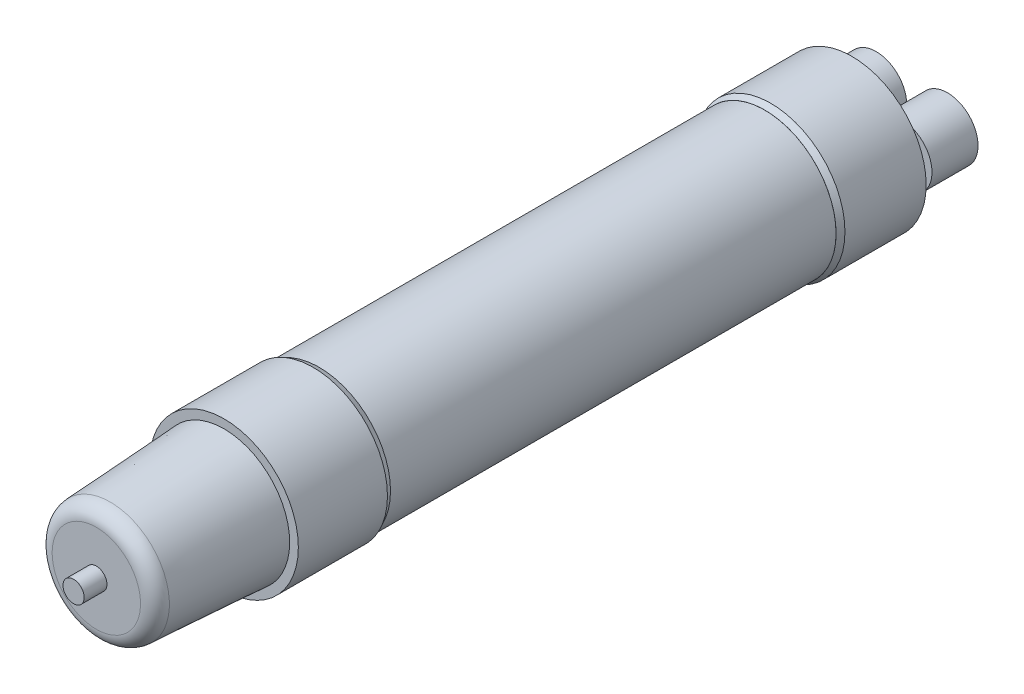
SolidWorks part; units mm, degrees
ref_plane "Plane1" through (0, 0, 0) normal (0, 0, 1) x (1, 0, 0)
ref_plane "Plane2" through (0, 0, 0) normal (0, 1, 0) x (1, 0, 0)
ref_plane "Plane3" through (0, 0, 0) normal (1, 0, 0) x (0, 0, -1)
sketch "Sketch1" plane through (0, 0, 0) normal (0, 0, 1) x (1, 0, 0)
  circle A0 centre (0, 0) radius 31.75
  dimension "D1" = 63.5
extrude "EndCap" add sketch "Sketch1" along normal blind 43.18
sketch "Sketch2" plane through (0, 0, 43.18) normal (0, 0, 1) x (1, 0, 0)
  circle A0 centre (0, 0) radius 30.48
  dimension "D1" = 60.96
extrude "Can" add sketch "Sketch2" along normal blind 190.5
sketch "Sketch3" plane through (0, 0, 233.68) normal (0, 0, 1) x (1, 0, 0)
  circle A0 centre (0, 0) radius 31.75
  dimension "D1" = 63.5
extrude "EndCap2" add sketch "Sketch3" along normal blind 40.64
sketch "Sketch4" plane through (0, 0, 0) normal (0, 1, 0) x (1, 0, 0)
  line L0 (0, 0) -> (0, -348.1702) construction
  line L1 (0, -43.18) -> (0, 0) construction
  line L2 (0, -274.32) -> (-99.0456, -274.32) construction
  line L3 (0, -274.32) -> (-28.0416, -274.32)
  line L4 (-28.0416, -274.32) -> (-25.2371, -322.9456)
  line L5 (-18.8977, -328.93) -> (0, -328.93)
  line L6 (-31.75, -274.32) -> (31.75, -274.32) construction
  line L7 (0, -274.32) -> (0, -328.93)
  arc A0 (-25.2371, -322.9456) -> (-18.8977, -328.93) centre (-18.8977, -322.58) ccw
  point P12 (-24.892, -328.93)
  dimension "D4" = 6.35
  dimension "D1" = 28.0416
  dimension "D2" = 24.892
  dimension "D3" = 54.61
revolve "Hydrophone" add sketch "Sketch4" angle 360 about L0
chamfer "Chamfer1" distance 12.7 angle 25
chamfer "Chamfer5" distance 2.54 angle 26
chamfer "Chamfer6" distance 2.54 angle 26
sketch "Sketch5" plane through (0, 0, 328.93) normal (0, 0, 1) x (1, 0, 0)
  circle A0 centre (0, 0) radius 4.5339
  dimension "D1" = 9.0678
extrude "HydrophoneBolt" add sketch "Sketch5" along normal blind 9.7282
sketch "Sketch6" plane through (0, 0, 0) normal (0, 0, -1) x (-1, 0, 0)
  line L0 (-34.4542, 0) -> (44.4747, 0) construction
  line L2 (0, 24.1591) -> (0, -26.4927) construction
  circle A0 centre (-15.24, 0) radius 13.081
  circle A1 centre (15.24, 0) radius 13.081
  dimension "D1" = 26.162
  dimension "D2" = 15.24
extrude "Zincs" add sketch "Sketch6" along normal blind 19.685
